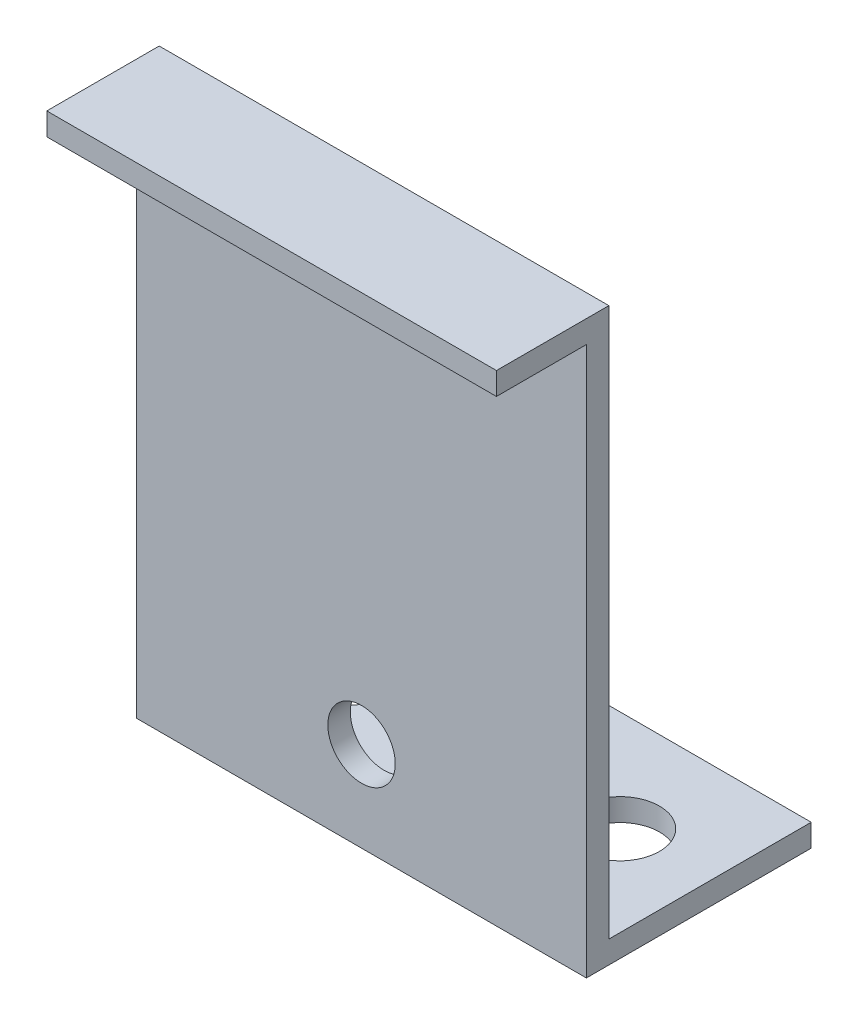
SolidWorks part; units mm, degrees
ref_plane "Front Plane" through (0, 0, 0) normal (0, 0, 1) x (1, 0, 0)
ref_plane "Top Plane" through (0, 0, 0) normal (0, 1, 0) x (1, 0, 0)
ref_plane "Right Plane" through (0, 0, 0) normal (1, 0, 0) x (0, 0, -1)
sketch "Sketch1" plane through (0, 0, 0) normal (1, 0, 0) x (0, 0, -1)
  line L0 (10, 0) -> (0, 0)
  line L1 (0, 0) -> (0, 24.4)
  line L2 (0, 24.4) -> (-4, 24.4)
  line L3 (10, 1) -> (1, 1)
  line L4 (1, 1) -> (1, 25.4)
  line L5 (1, 25.4) -> (-4, 25.4)
  line L6 (-4, 25.4) -> (-4, 24.4)
  line L7 (10, 1) -> (10, 0)
  dimension "D2" = 10
  dimension "D3" = 5
  dimension "D4" = 24.4
  dimension "D1" = 1
extrude "Extrude1" add sketch "Sketch1" along normal blind 20
sketch "Sketch2" plane through (0, 1, 0) normal (0, 1, 0) x (1, 0, 0)
  line L0 (20, 5.5) -> (0, 5.5) construction
  line L3 (10, 1) -> (10, 10) construction
  line L4 (20, 1) -> (0, 1) construction
  line L5 (20, 10) -> (0, 10) construction
  line L6 (20, 10) -> (20, 1) construction
  line L7 (0, 10) -> (0, 1) construction
  circle A0 centre (4, 5.5) radius 1.75
  circle A1 centre (16, 5.5) radius 1.75
  dimension "D1" = 12
  dimension "D2" = 3.5
  dimension "D3" = 6
extrude "Extrude2" cut sketch "Sketch2" against normal blind 20
sketch "Sketch3" plane through (0, 0, -1) normal (0, 0, -1) x (-1, 0, 0)
  line L0 (-10, 1) -> (-10, 25.4) construction
  line L1 (-20, 1) -> (0, 1) construction
  line L2 (-20, 25.4) -> (0, 25.4) construction
  line L3 (-20, 13.2) -> (0, 13.2) construction
  line L4 (-20, 1) -> (-20, 25.4) construction
  line L5 (0, 1) -> (0, 25.4) construction
  circle A0 centre (-10, 22.4) radius 1.5
  circle A1 centre (-10, 4) radius 1.5
  dimension "D1" = 18.4
  dimension "D2" = 3
  dimension "D3" = 3
  dimension "D4" = 9.2
extrude "Extrude3" cut sketch "Sketch3" against normal blind 20
